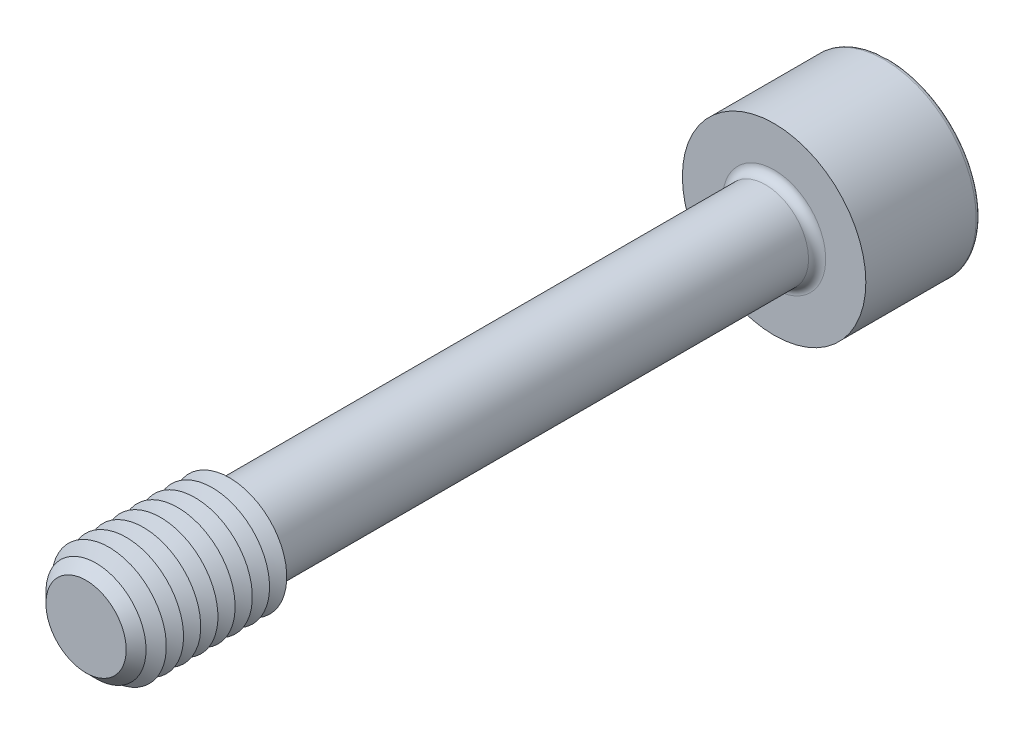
SolidWorks part; units mm, degrees
ref_plane "Front Plane" through (0, 0, 0) normal (0, 0, 1) x (1, 0, 0)
ref_plane "Top Plane" through (0, 0, 0) normal (0, 1, 0) x (1, 0, 0)
ref_plane "Right Plane" through (0, 0, 0) normal (1, 0, 0) x (0, 0, -1)
sketch "Sketch1" plane through (0, 0, 0) normal (0, 0, 1) x (1, 0, 0)
  circle A0 centre (0, 0) radius 3.75
  dimension "D1" = 7.5
extrude "Extrude1" add sketch "Sketch1" along normal mid plane 60
sketch "Sketch2" plane through (0, 0, 0) normal (1, 0, 0) x (0, 0, -1)
  line L0 (-30, 0) -> (-30, 5)
  line L1 (-30, 3.75) -> (-30, -3.75) construction
  line L2 (-30, 5) -> (-17.5, 5)
  line L3 (-17.5, 5) -> (-16.7783, 3.75)
  line L4 (30, 3.75) -> (-30, 3.75) construction
  line L5 (-16.7783, 3.75) -> (-16.7783, 0)
  line L6 (-16.7783, 0) -> (-30, 0)
  dimension "D1" = 5
  dimension "D2" = 120
  dimension "D3" = 12.5
revolve "Revolve1" add sketch "Sketch2" angle 360 about L6
chamfer "Chamfer1" distance 1.5 angle 45 1 edges at (0, 5, 30)
sketch "Sketch3" plane through (0, 0, -30) normal (0, 0, -1) x (-1, 0, 0)
  circle A0 centre (0, 0) radius 8
  dimension "D1" = 16
extrude "Extrude2" add sketch "Sketch3" along normal blind 10
sketch "Sketch4" plane through (-13.7, 0, -40) normal (0, 0, 1) x (1, 0, 0)
  line L2 (11.3906, -4) -> (16.0094, -4)
  line L3 (16.0094, -4) -> (18.3188, 0)
  line L4 (18.3188, 0) -> (16.0094, 4)
  line L6 (16.0094, 4) -> (11.3906, 4)
  line L7 (11.3906, 4) -> (9.0812, 0)
  line L8 (9.0812, 0) -> (11.3906, -4)
  circle A0 centre (13.7, 0) radius 4 construction
  dimension "D1" = 8
extrude "Extrude3" cut sketch "Sketch4" along normal blind 8
fillet "Fillet1" radius 0.75 1 edges at (-3.75, 0, -30)
fillet "Fillet2" radius 0.375 1 edges at (-8, 0, -40)
sketch "Sketch5" plane through (0, 0, 0) normal (1, 0, 0) x (0, 0, -1)
  line L0 (32, 0) -> (32, -4)
  line L1 (32, -4) -> (29.6906, 0)
  line L2 (29.6906, 0) -> (32, 0)
  dimension "D1" = 30
revolve "Cut-Revolve1" cut sketch "Sketch5" angle 360 about L2
sketch "Sketch6" plane through (0, 0, 0) normal (1, 0, 0) x (0, 0, -1)
  line L0 (1.332, 0) -> (-13.289, 0) construction
sketch "Sketch7" plane through (0, 0, 0) normal (1, 0, 0) x (0, 0, -1)
  line L0 (-17.5, 5) -> (-18.25, 3.701)
  line L1 (-18.25, 3.701) -> (-19, 5)
  line L2 (-17.5, 5) -> (-28.5, 5) construction
  line L3 (-19, 5) -> (-17.5, 5)
  dimension "D1" = 1.5
revolve "Cut-Revolve2" cut sketch "Sketch7" angle 360 about L0
pattern_linear "LPattern1" count 8 spacing 1.5 along (0, 0, 1) of "Cut-Revolve2"
